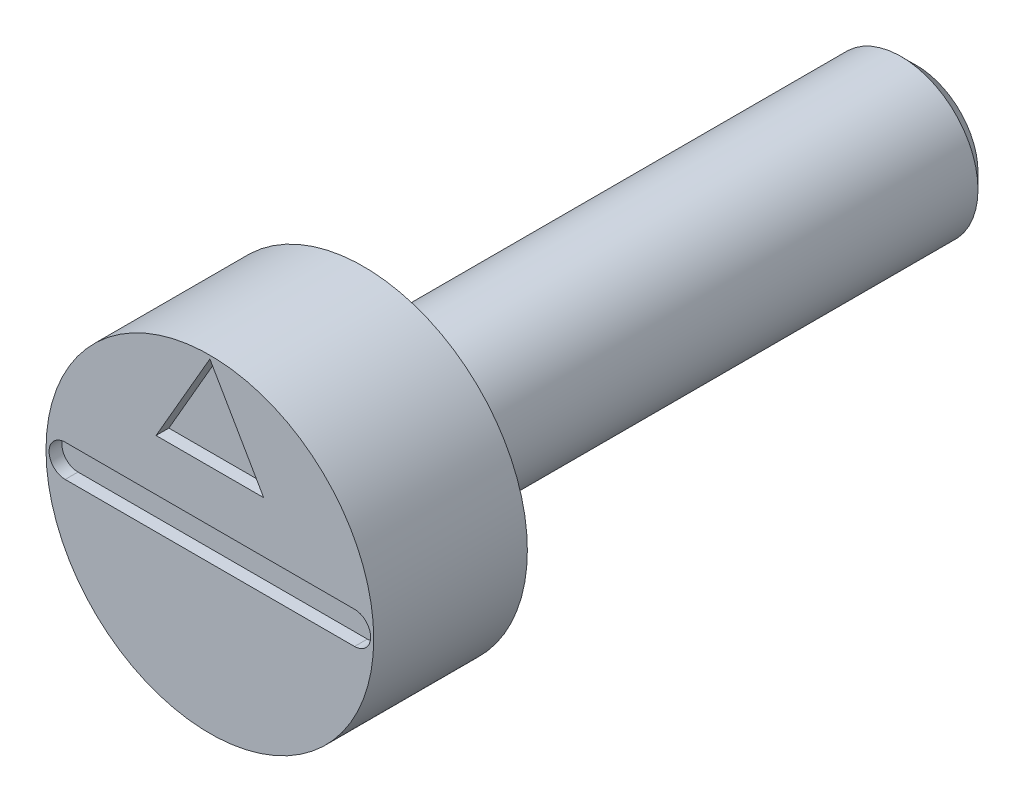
SolidWorks part; units mm, degrees
ref_plane "Front Plane" through (0, 0, 0) normal (0, 0, 1) x (1, 0, 0)
ref_plane "Top Plane" through (0, 0, 0) normal (0, 1, 0) x (1, 0, 0)
ref_plane "Right Plane" through (0, 0, 0) normal (1, 0, 0) x (0, 0, -1)
imported_body "Imported1"
sketch "Sketch2" plane through (0, 0, 0) normal (0, 1, 0) x (1, 0, 0)
  line L0 (1.75, 24) -> (-1.75, 24) construction
  line L1 (1.5, 24) -> (1.75, 24)
  line L2 (1.5, 24) -> (1.5, 3)
  line L3 (1.5, 3) -> (1.75, 3)
  line L4 (1.75, 24) -> (1.75, 3)
  line L5 (3.2, 3) -> (-3.2, 3) construction
  line L6 (1.75, 3) -> (1.75, 24) construction
  line L7 (0, 24) -> (0, 26.7548) construction
  dimension "D1" = 3
revolve "Cut-Revolve1" cut sketch "Sketch2" angle 360 about L7
other "DeleteFace1"
sketch "Sketch1" plane through (0, 0, 0) normal (0, 0, 1) x (1, 0, 0)
  line L0 (0, 3.135) -> (-1.0508, 1.315)
  line L1 (-1.0508, 1.315) -> (1.0508, 1.315)
  line L2 (1.0508, 1.315) -> (0, 3.135)
  line L4 (-2.825, 0.315) -> (2.825, 0.315)
  line L6 (-2.825, -0.315) -> (2.825, -0.315)
  arc A0 (-2.825, 0.315) -> (-2.825, -0.315) centre (-2.825, 0) ccw
  arc A1 (2.825, -0.315) -> (2.825, 0.315) centre (2.825, 0) ccw
  dimension "D5" = 6.28
  dimension "D6" = 3.14
  dimension "D1" = 1.82
  dimension "D2" = 60
  dimension "D3" = 60
  dimension "D4" = 0.63
  dimension "D7" = 0.315
  dimension "D8" = 1
extrude "Cut-Extrude1" cut sketch "Sketch1" against normal blind 0.25
sketch "Sketch3" plane through (0, 0, -24) normal (0, 0, -1) x (-1, 0, 0)
  circle A1 centre (0, 0) radius 1.5
  circle A2 centre (0, 0) radius 1.5
  dimension "D1" = 0
extrude "Cut-Extrude2" cut sketch "Sketch3" against normal offset from surface (10.2 mm away) 13.8
chamfer "Chamfer1" distance 0.3 angle 45 1 edges at (1.5, 0, -13.8)
